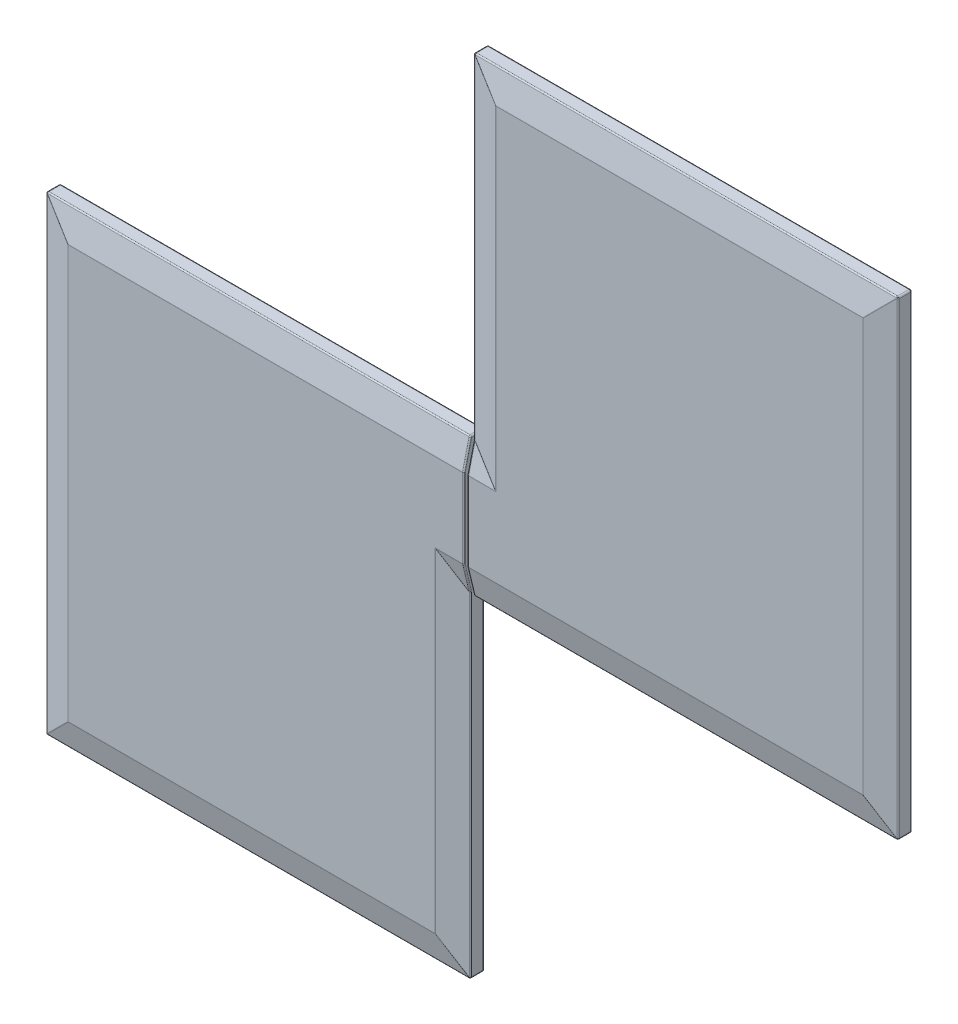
SolidWorks part; units mm, degrees
ref_plane "Plan de face" through (0, 0, 0) normal (0, 0, 1) x (1, 0, 0)
ref_plane "Plan de dessus" through (0, 0, 0) normal (0, 1, 0) x (1, 0, 0)
ref_plane "Plan de droite" through (0, 0, 0) normal (1, 0, 0) x (0, 0, -1)
sketch "Esquisse2" plane through (0, 0, 0) normal (1, 0, 0) x (0, 0, -1)
  line L0 (0, 590) -> (0, -590)
  line L1 (0, 590) -> (-20, 590)
  line L2 (-20, 590) -> (-30, 548.179)
  line L3 (-30, 548.179) -> (-30, -548.179)
  line L4 (-30, -548.179) -> (-20, -590)
  line L5 (-20, -590) -> (0, -590)
  dimension "D1" = 1180
  dimension "D2" = 30
  dimension "D3" = 20
  dimension "D4" = 43
extrude "Boss.-Extru.1" add sketch "Esquisse2" along normal mid plane 1250
sketch "Esquisse3" plane through (0, 0, 30) normal (0, 0, 1) x (1, 0, 0)
  line L0 (625, 590) -> (-625, 590) construction
  line L1 (-2.5, 590) -> (2.5, 590)
  line L2 (-2.5, 590) -> (-2.5, -590)
  line L3 (-2.5, -590) -> (2.5, -590)
  line L4 (2.5, 590) -> (2.5, -590)
  line L5 (625, -590) -> (-625, -590) construction
  point P8 (0, -590)
  dimension "D1" = 5
extrude "Enlèv. mat.-Extru.1" cut sketch "Esquisse3" against normal through all
sketch "Esquisse4" plane through (0, 0, 30) normal (0, 0, 1) x (1, 0, 0)
  line L0 (-2.5, 548.179) -> (-2.5, -548.179) construction
  line L1 (-625, 590) -> (-2.5, 590)
  line L2 (-625, 590) -> (-625, 100)
  line L3 (-625, 100) -> (-2.5, 100)
  line L4 (-2.5, 590) -> (-2.5, 100)
  line L5 (2.5, -548.179) -> (2.5, 548.179) construction
  line L6 (625, -590) -> (2.5, -590)
  line L7 (625, -590) -> (625, -100)
  line L8 (625, -100) -> (2.5, -100)
  line L9 (2.5, -590) -> (2.5, -100)
  dimension "D1" = 490
  dimension "D2" = 200
  dimension "D3" = 490
extrude "Enlèv. mat.-Extru.2" cut sketch "Esquisse4" against normal through all
sketch "Esquisse5" plane through (625, 0, 0) normal (1, 0, 0) x (0, 0, -1)
  line L0 (-20, -100) -> (-30, -58.179)
  line L1 (0, -100) -> (-30, -100) construction
  line L2 (-30, 548.179) -> (-30, -100) construction
  line L3 (-30, -58.179) -> (-30, -100)
  line L4 (-30, -100) -> (-20, -100)
  line L5 (0, 100) -> (0, -590) construction
  dimension "D1" = 20
  dimension "D2" = 43
extrude "Enlèv. mat.-Extru.3" cut sketch "Esquisse5" against normal up to next
sketch "Esquisse6" plane through (-625, 0, 0) normal (-1, 0, 0) x (0, 0, 1)
  line L0 (20, 100) -> (30, 58.179)
  line L1 (0, 100) -> (30, 100) construction
  line L2 (30, 100) -> (30, -548.179) construction
  line L3 (30, 58.179) -> (30, 100)
  line L4 (30, 100) -> (20, 100)
  dimension "D1" = 20
  dimension "D2" = 43
extrude "Enlèv. mat.-Extru.4" cut sketch "Esquisse6" against normal up to next
sketch "Esquisse7" plane through (0, 590, 0) normal (0, 1, 0) x (1, 0, 0)
  line L0 (625, -20) -> (583.179, -30)
  line L1 (625, -30) -> (2.5, -30) construction
  line L2 (583.179, -30) -> (625, -30)
  line L3 (625, -30) -> (625, -20)
  line L4 (-625, -20) -> (-583.179, -30)
  line L5 (-2.5, -30) -> (-625, -30) construction
  line L6 (-583.179, -30) -> (-625, -30)
  line L7 (-625, -30) -> (-625, -20)
  dimension "D1" = 43
  dimension "D2" = 43
extrude "Enlèv. mat.-Extru.5" cut sketch "Esquisse7" against normal through all
sketch "Esquisse8" plane through (0, 590, 0) normal (0, 1, 0) x (1, 0, 0)
  line L0 (2.5, -20) -> (44.321, -30)
  line L1 (583.179, -30) -> (2.5, -30) construction
  line L2 (44.321, -30) -> (2.5, -30)
  line L3 (2.5, -30) -> (2.5, -20)
  dimension "D1" = 43
extrude "Enlèv. mat.-Extru.6" cut sketch "Esquisse8" against normal up to surface (531.821 mm away)
sketch "Esquisse9" plane through (0, -590, 0) normal (0, -1, 0) x (1, 0, 0)
  line L0 (-2.5, 20) -> (-44.321, 30)
  line L1 (-2.5, 30) -> (-583.179, 30) construction
  line L2 (-44.321, 30) -> (-2.5, 30)
  line L3 (-2.5, 30) -> (-2.5, 20)
  dimension "D1" = 43
extrude "Enlèv. mat.-Extru.7" cut sketch "Esquisse9" against normal up to surface (531.821 mm away)
fillet "Congé1" radius 2.5 4 edges at (2.5, -100, 10) (625, -100, 10) (2.5, 590, 10) (625, 590, 10)
fillet "Congé2" radius 2 31 edges at (623.4567, -99.8097, 20.0455) (313.75, -100, 20) (3.2322, -99.2678, 20.1751) (2.5, -77.8395, 25.2989) (2.5, 79.0895, 25) (23.4105, 79.0895, 25) (2.5, 343.75, 20) (2.6903, 588.4567, 20.0455) (624.8097, 588.4567, 20.0455) (625, 245, 20) (624.8097, -98.4567, 20.0455) (603.7234, -78.7234, 25.0875) (623.4567, 589.8097, 20.0455) (603.7234, 568.7234, 25.0875) (23.7766, 568.7234, 25.0875) (4.0433, 589.8097, 20.0455) (313.75, 590, 20) (313.75, 548.179, 30) (583.179, 245, 30) (292.8395, -58.179, 30) (2.5, 0, 30) (23.4105, 58.179, 30) (44.321, 303.179, 30) (624.2678, -99.2678, 0) (625, 245, 0) (624.2678, 589.2678, 0) (313.75, 590, 0) (3.2322, 589.2678, 0) (2.5, 245, 0) (3.2322, -99.2678, 0) (313.75, -100, 0)
fillet "Congé3" radius 2.5 4 edges at (-625, -590, 10) (-2.5, -590, 10) (-2.5, 100, 10) (-625, 100, 10)
fillet "Congé4" radius 2 31 edges at (-3.2322, -589.2678, 0) (-3.2322, 99.2678, 0) (-313.75, 100, 0) (-624.2678, 99.2678, 0) (-624.2678, -589.2678, 0) (-625, -245, 0) (-313.75, -590, 0) (-4.0433, -589.8097, 20.0455) (-313.75, -590, 20) (-623.4567, -589.8097, 20.0455) (-2.5, -245, 0) (-2.5, -79.0895, 25) (-23.4105, -79.0895, 25) (-2.5, -343.75, 20) (-2.6903, -588.4567, 20.0455) (-23.7766, -568.7234, 25.0875) (-624.8097, 98.4567, 20.0455) (-603.7234, -568.7234, 25.0875) (-624.8097, -588.4567, 20.0455) (-625, -245, 20) (-603.7234, 78.7234, 25.0875) (-623.4567, 99.8097, 20.0455) (-313.75, 100, 20) (-3.2322, 99.2678, 20.1751) (-2.5, 77.8395, 25.2989) (-313.75, -548.179, 30) (-583.179, -245, 30) (-292.8395, 58.179, 30) (-2.5, 0, 30) (-23.4105, -58.179, 30) (-44.321, -303.179, 30)
